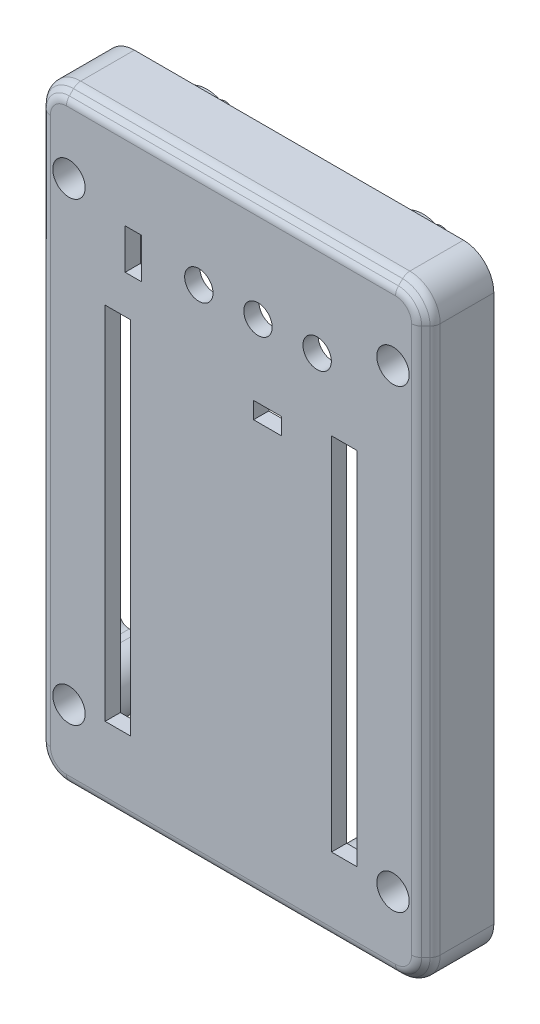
SolidWorks part; units mm, degrees
ref_plane "Front Plane" through (0, 0, 0) normal (0, 0, 1) x (1, 0, 0)
ref_plane "Top Plane" through (0, 0, 0) normal (0, 1, 0) x (1, 0, 0)
ref_plane "Right Plane" through (0, 0, 0) normal (1, 0, 0) x (0, 0, -1)
body saved out of another part "Stock-Enclosure^Shadowfang_Enclosure_V1-1"
fillet "Fillet1" radius 1 8 edges at (-17.965, 19.7787, 5.8355) (-17.965, 25.2787, 5.8355) (17.535, 25.2787, 5.8355) (17.535, 19.7787, 5.8355) (17.535, -25.2213, 5.8355) (17.535, -19.7213, 5.8355) (-17.965, -19.7213, 5.8355) (-17.965, -25.2213, 5.8355)
sketch "Sketch1" plane through (0, 0, 8.5) normal (0, 0, -1) x (-1, 0, 0)
  circle A0 centre (-10.453, 25.6827) radius 3
  circle A1 centre (10.883, 25.6827) radius 3
  circle A2 centre (-10.453, -25.6253) radius 3
  circle A3 centre (10.883, -25.6253) radius 3
  dimension "D1" = 6
extrude "Boss-Extrude1" add sketch "Sketch1" along normal blind 6.8
sketch "Sketch2" plane through (0, 0, 1.7) normal (0, 0, -1) x (-1, 0, 0)
  circle A1 centre (10.883, 25.6827) radius 1.075
  circle A2 centre (-10.453, 25.6827) radius 1.075
  circle A3 centre (-10.453, -25.6253) radius 1.075
  circle A4 centre (10.883, -25.6253) radius 1.075
  dimension "D1" = 2.15
extrude "Boss-Extrude2" add sketch "Sketch2" along normal blind 1.8
